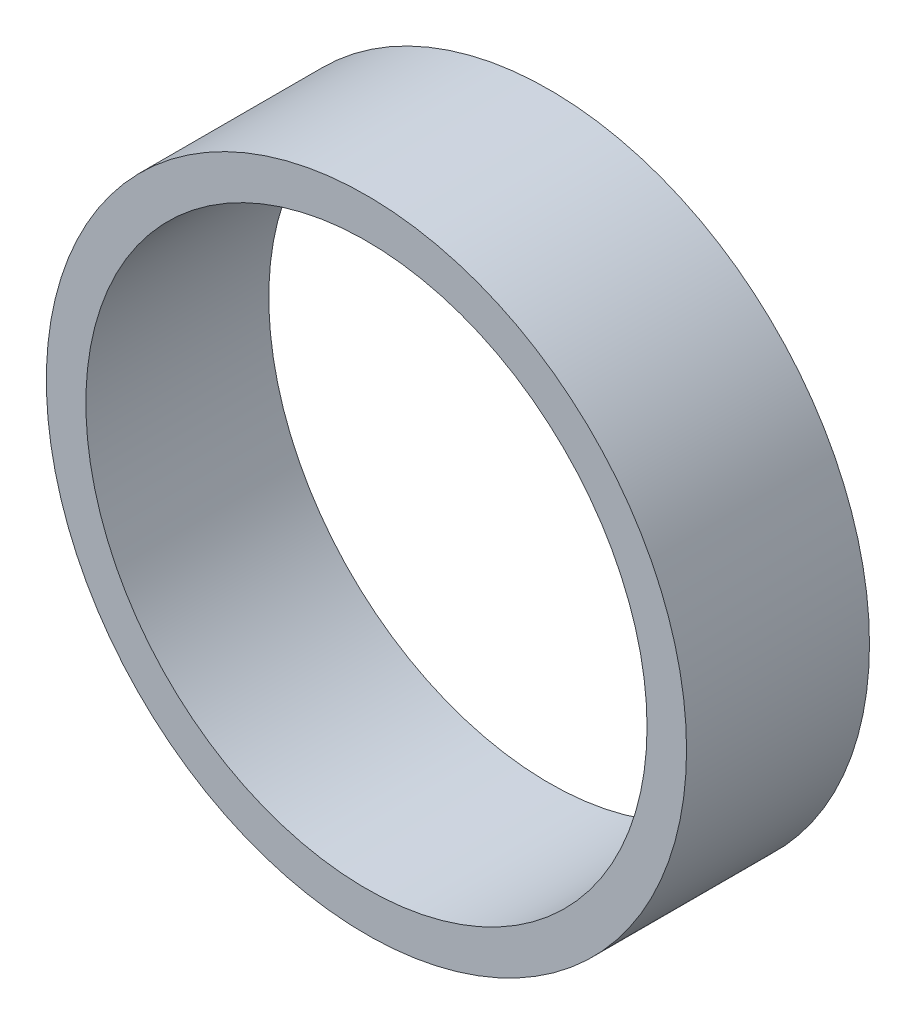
SolidWorks part; units mm, degrees
ref_plane "Plane1" through (0, 0, 0) normal (0, 0, 1) x (1, 0, 0)
ref_plane "Plane2" through (0, 0, 0) normal (0, 1, 0) x (1, 0, 0)
ref_plane "Plane3" through (0, 0, 0) normal (1, 0, 0) x (0, 0, -1)
other "Configuration Table"
sketch "Sketch1" plane through (0, 0, 0) normal (0, 0, 1) x (1, 0, 0)
  circle A0 centre (0, 0) radius 38.9636
  circle A1 centre (0, 0) radius 44.45
extrude "BasePipe" add sketch "Sketch1" along normal mid plane 25.4
